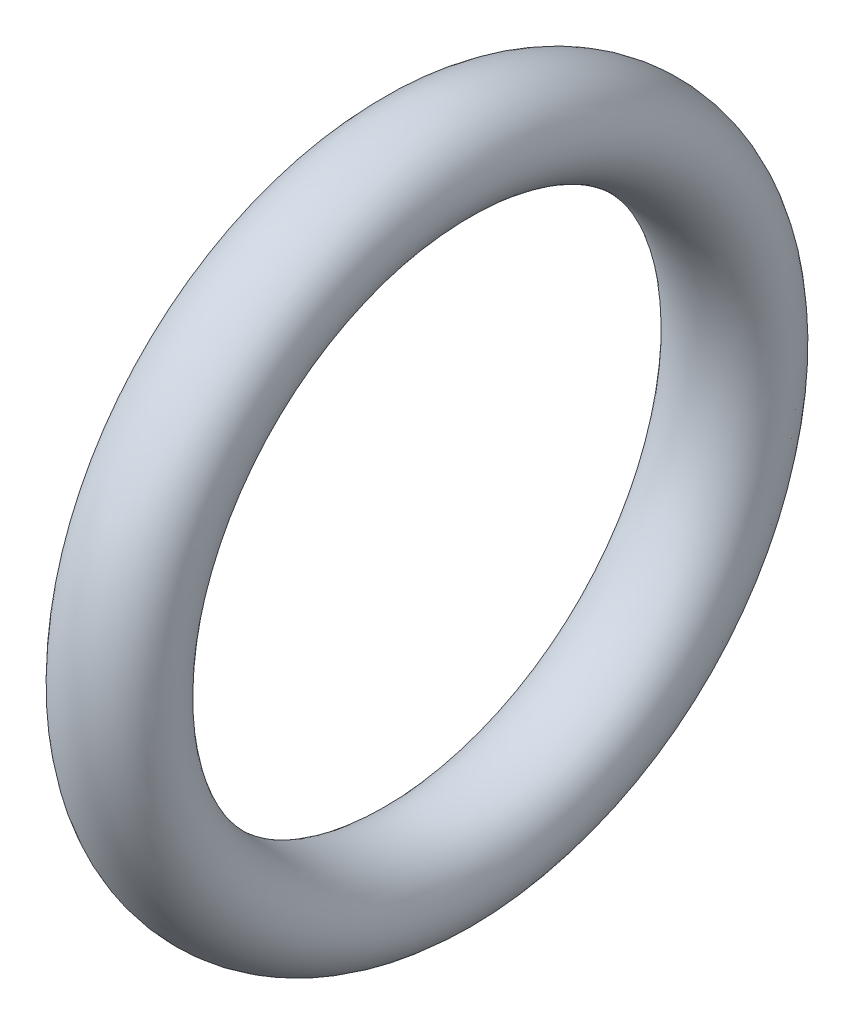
SolidWorks part; units mm, degrees
ref_plane "Plan de face" through (0, 0, 0) normal (0, 0, 1) x (1, 0, 0)
ref_plane "Plan de dessus" through (0, 0, 0) normal (0, 1, 0) x (1, 0, 0)
ref_plane "Plan de droite" through (0, 0, 0) normal (1, 0, 0) x (0, 0, -1)
sketch "Esquisse1" plane through (0, 0, 0) normal (0, 0, 1) x (1, 0, 0)
  line L0 (-5.3489, 0) -> (4.8795, 0) construction
  ellipse E0 centre (0, 5.2) end of major axis (0.95, 5.2) minor radius 0.8
  dimension "D1" = 1.9
  dimension "D2" = 5.2
  dimension "D3" = 1.6
revolve "Révolution1" add sketch "Esquisse1" angle 360 about L0
